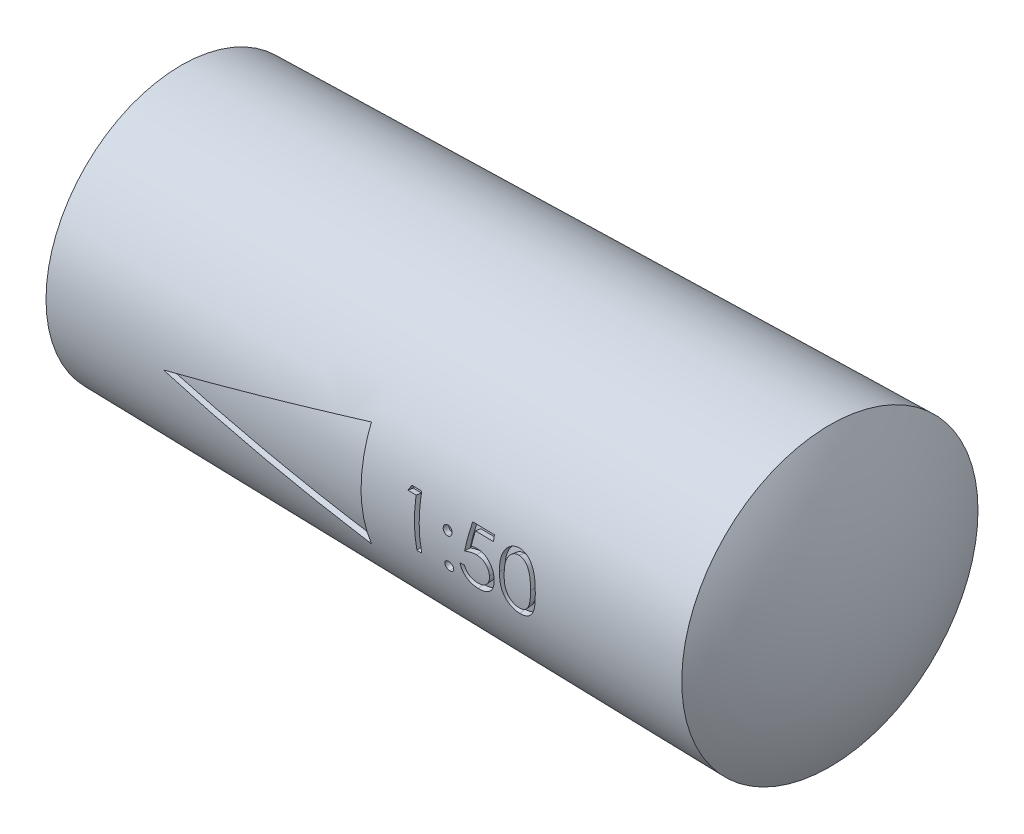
SolidWorks part; units mm, degrees
ref_plane "Front Plane" through (0, 0, 0) normal (0, 0, 1) x (1, 0, 0)
ref_plane "Top Plane" through (0, 0, 0) normal (0, 1, 0) x (1, 0, 0)
ref_plane "Right Plane" through (0, 0, 0) normal (1, 0, 0) x (0, 0, -1)
sketch "Sketch1" plane through (0, 0, 0) normal (1, 0, 0) x (0, 0, -1)
  circle A0 centre (0, 0) radius 2.5
  dimension "D1" = 5
extrude "Extrude1" add sketch "Sketch1" along normal mid plane 12
draft "Draft1" type of draft neutral plane draft angle 1.146 faces to draft 1 parameters "D1"=1.146
sketch "Sketch2" plane through (0, 0, 0) normal (0, 0, 1) x (1, 0, 0)
  line L0 (-6, 0) -> (-6, 2.5)
  line L1 (-6, 2.5) -> (-6, -2.5) construction
  line L2 (-6, 0) -> (-6.75, 0)
  line L3 (-6.75, 0) -> (-6.75, -2.62) construction
  line L4 (6, 0) -> (6, 2.74)
  line L5 (6, -2.74) -> (6, 2.74) construction
  line L6 (6, 0) -> (6.75, 0)
  line L7 (6.75, 0) -> (6.75, -2.62) construction
  line L8 (-6, -2.5) -> (6, -2.74) construction
  arc A0 (-6.75, 0) -> (-6, 2.5) centre (-2.2083, 0) cw
  arc A1 (6.75, 0) -> (6, 2.74) centre (1.3699, 0) ccw
  point P14 (0, -2.62)
revolve "Revolve1" add sketch "Sketch2" angle 360 about L2
sketch "Sketch5" plane through (0, 0, 0) normal (0, 0, 1) x (1, 0, 0)
  line L0 (0, 2.62) -> (0, -2.62) construction
  line L1 (6, 2.74) -> (-6, 2.5) construction
  line L2 (-6, -2.5) -> (6, -2.74) construction
ref_plane "Plane2" through (0, 0, 0) normal (-0.02, 0, 0.9998) x (0.9998, 0, 0.02)
sketch "Sketch6" plane through (0, 0, 0) normal (-0.02, 0, 0.9998) x (0.9998, 0, 0.02)
  line L0 (0, 0) -> (0, 1)
  line L1 (0, 2.62) -> (0, -2.62) construction
  line L2 (0, 1) -> (-3.7321, 0)
  line L3 (-3.7321, 0) -> (0, -1)
  line L4 (0, -1) -> (0, 0)
  line L5 (0, -0.5) -> (4, -0.5) construction
  text T0 "1:50" font "Century Gothic" height 1
  dimension "D1" = 2
  dimension "D2" = 30
  dimension "D3" = 4
wrap "Wrap2" sketch "Sketch6" wrap type deboss source sketch "Sketch6" thickness 0.1 parameters "D1"=0.1
equation "\"D2@Sketch2\" = \"D1@Sketch2\""
